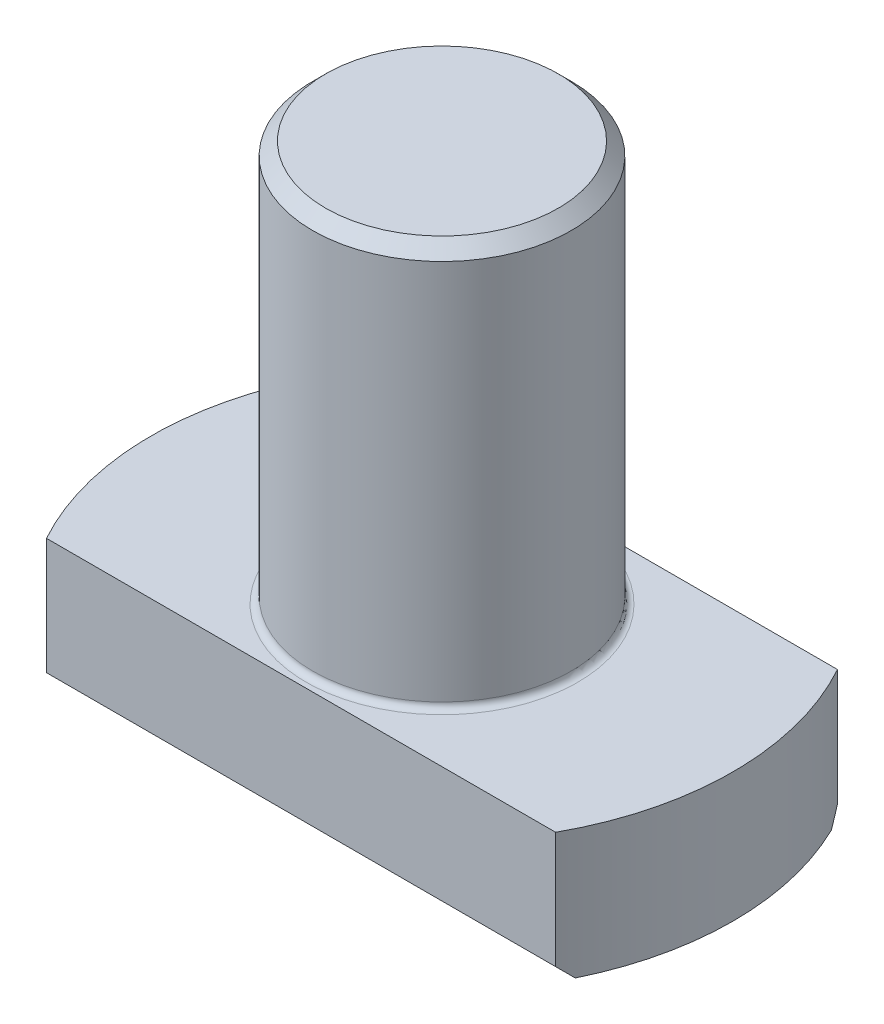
SolidWorks part; units mm, degrees
ref_plane "Plan de face" through (0, 0, 0) normal (0, 0, 1) x (1, 0, 0)
ref_plane "Plan de dessus" through (0, 0, 0) normal (0, 1, 0) x (1, 0, 0)
ref_plane "Plan de droite" through (0, 0, 0) normal (1, 0, 0) x (0, 0, -1)
sketch "Esquisse2" plane through (0, 0, 0) normal (0, 1, 0) x (1, 0, 0)
  circle A0 centre (0, 0) radius 10
  dimension "D1" = 20
extrude "Boss.-Extru.1" add sketch "Esquisse2" along normal blind 31
chamfer "Chanfrein1" distance 1 angle 45 1 edges at (0, 31, 10)
sketch "Esquisse3" plane through (0, 0, 0) normal (0, -1, 0) x (1, 0, 0)
  line L0 (-19.6835, 10.9) -> (19.6835, 10.9)
  line L1 (-19.6835, -10.9) -> (19.6835, -10.9)
  line L2 (0, 0) -> (17.3655, 0) construction
  arc A0 (-19.6835, 10.9) -> (-19.6835, -10.9) centre (0, 0) ccw
  arc A1 (19.6835, -10.9) -> (19.6835, 10.9) centre (0, 0) ccw
  dimension "D1" = 45
  dimension "D2" = 21.8
extrude "Boss.-Extru.2" add sketch "Esquisse3" along normal blind 10
chamfer "Chanfrein2" distance 1 angle 45 2 edges at (0, -10, 10.9) (0, -10, -10.9)
fillet "Congé1" radius 0.5 1 edges at (0, 0, -10)
